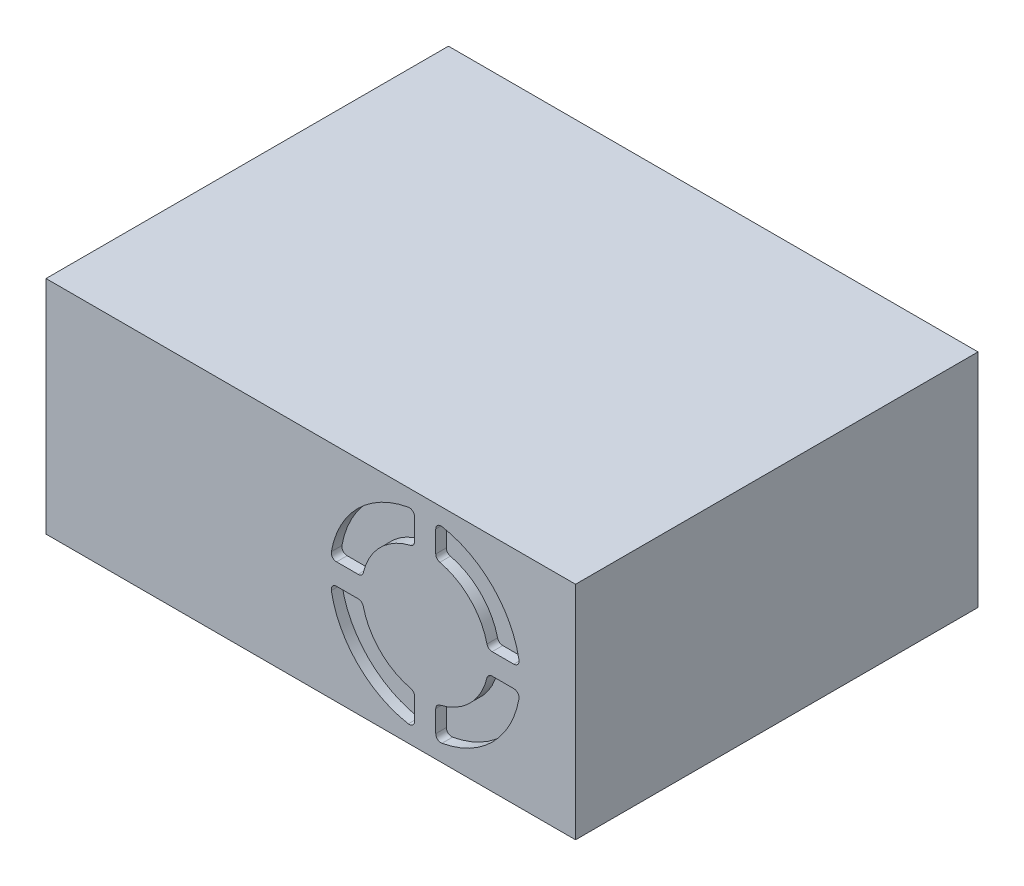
SolidWorks part; units mm, degrees
ref_plane "Front Plane" through (0, 0, 0) normal (0, 0, 1) x (1, 0, 0)
ref_plane "Top Plane" through (0, 0, 0) normal (0, 1, 0) x (1, 0, 0)
ref_plane "Right Plane" through (0, 0, 0) normal (1, 0, 0) x (0, 0, -1)
sketch "Sketch1" plane through (0, 0, 0) normal (0, 1, 0) x (1, 0, 0)
  line L1 (0, 0) -> (50, 0)
  line L2 (0, 0) -> (0, 38)
  line L3 (0, 38) -> (50, 38)
  line L4 (50, 0) -> (50, 38)
  dimension "D1" = 50
  dimension "D2" = 38
extrude "Boss-Extrude1" add sketch "Sketch1" along normal blind 20.9
sketch "Sketch2" plane through (0, 0, 0) normal (0, 0, 1) x (1, 0, 0)
  line L0 (50, 20.9) -> (50, 0) construction
  line L1 (0, 20.9) -> (0, 0) construction
  line L2 (42.1246, 11.45) -> (44.1666, 11.45)
  line L4 (34.8, 18.8166) -> (34.8, 16.7746)
  line L6 (36.8, 18.8166) -> (36.8, 16.7746)
  line L7 (27.4334, 11.45) -> (29.4754, 11.45)
  line L9 (27.4334, 9.45) -> (29.4754, 9.45)
  line L11 (42.1246, 9.45) -> (44.1666, 9.45)
  line L12 (36.8, 4.1254) -> (36.8, 2.0834)
  line L13 (34.8, 4.1254) -> (34.8, 2.0834)
  arc A0 (26.9412, 8.8618) -> (34.2118, 1.5912) centre (35.8, 10.45) ccw
  arc A1 (29.9619, 9.0654) -> (34.4154, 4.6119) centre (35.8, 10.45) ccw
  arc A2 (37.1846, 4.6119) -> (41.6381, 9.0654) centre (35.8, 10.45) ccw
  arc A3 (37.3882, 1.5912) -> (44.6588, 8.8618) centre (35.8, 10.45) ccw
  arc A4 (34.4154, 16.2881) -> (29.9619, 11.8346) centre (35.8, 10.45) ccw
  arc A5 (34.2118, 19.3088) -> (26.9412, 12.0382) centre (35.8, 10.45) ccw
  arc A6 (41.6381, 11.8346) -> (37.1846, 16.2881) centre (35.8, 10.45) ccw
  arc A7 (44.6588, 12.0382) -> (37.3882, 19.3088) centre (35.8, 10.45) ccw
  arc A8 (37.3882, 19.3088) -> (36.8, 18.8166) centre (37.3, 18.8166) ccw
  arc A9 (36.8, 16.7746) -> (37.1846, 16.2881) centre (37.3, 16.7746) ccw
  arc A10 (42.1246, 11.45) -> (41.6381, 11.8346) centre (42.1246, 11.95) cw
  arc A11 (44.6588, 12.0382) -> (44.1666, 11.45) centre (44.1666, 11.95) cw
  arc A12 (44.6588, 8.8618) -> (44.1666, 9.45) centre (44.1666, 8.95) ccw
  arc A13 (42.1246, 9.45) -> (41.6381, 9.0654) centre (42.1246, 8.95) ccw
  arc A14 (37.1846, 4.6119) -> (36.8, 4.1254) centre (37.3, 4.1254) ccw
  arc A15 (37.3882, 1.5912) -> (36.8, 2.0834) centre (37.3, 2.0834) cw
  arc A16 (34.2118, 1.5912) -> (34.8, 2.0834) centre (34.3, 2.0834) ccw
  arc A17 (34.4154, 4.6119) -> (34.8, 4.1254) centre (34.3, 4.1254) cw
  arc A18 (29.9619, 9.0654) -> (29.4754, 9.45) centre (29.4754, 8.95) ccw
  arc A19 (27.4334, 9.45) -> (26.9412, 8.8618) centre (27.4334, 8.95) ccw
  arc A20 (29.9619, 11.8346) -> (29.4754, 11.45) centre (29.4754, 11.95) cw
  arc A21 (27.4334, 11.45) -> (26.9412, 12.0382) centre (27.4334, 11.95) cw
  arc A22 (34.8, 16.7746) -> (34.4154, 16.2881) centre (34.3, 16.7746) cw
  arc A23 (34.2118, 19.3088) -> (34.8, 18.8166) centre (34.3, 18.8166) cw
  point P6 (50, 10.45)
  point P28 (41.7161, 11.45)
  point P37 (36.8, 4.5339)
  point P44 (34.8, 4.5339)
  point P55 (34.8, 16.3661)
  dimension "D1" = 18
  dimension "D2" = 12
  dimension "D4" = 0.5
  dimension "D3" = 35.8
extrude "Cut-Extrude1" cut sketch "Sketch2" against normal blind 1
